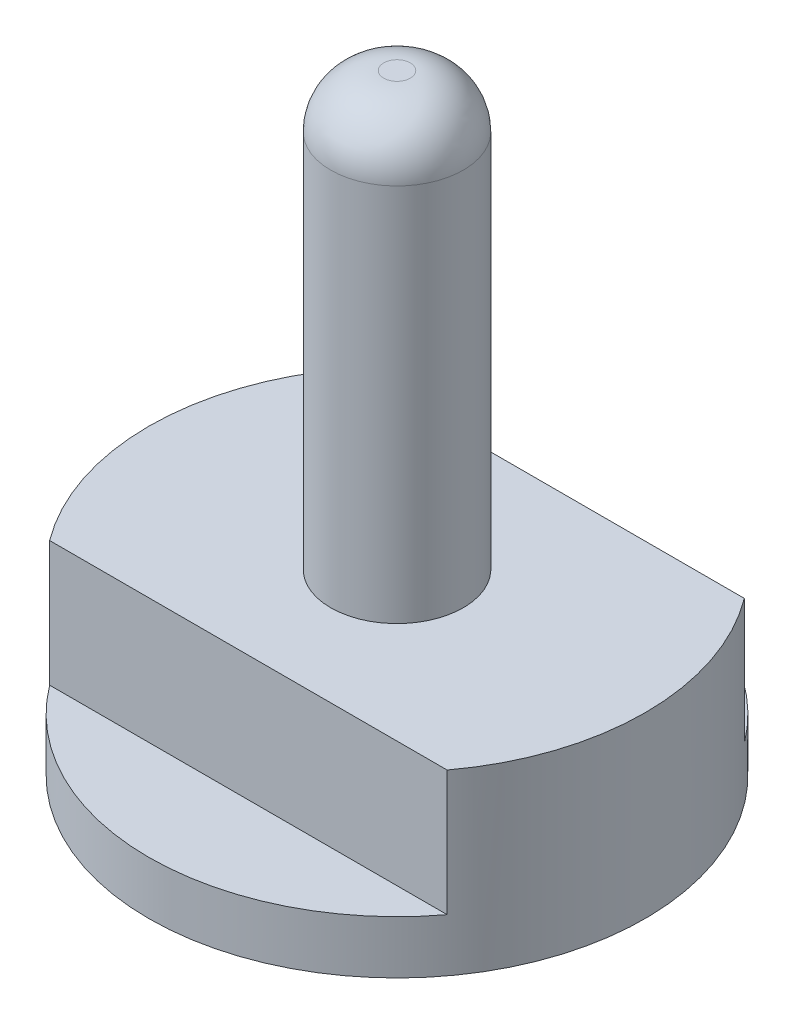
SolidWorks part; units mm, degrees
ref_plane "Plane1" through (0, 0, 0) normal (0, 0, 1) x (1, 0, 0)
ref_plane "Plane2" through (0, 0, 0) normal (0, 1, 0) x (1, 0, 0)
ref_plane "Plane3" through (0, 0, 0) normal (1, 0, 0) x (0, 0, -1)
sketch "Sketch2" plane through (0, 3.36, 0) normal (0, 1, 0) x (-1, 0, 0)
  line L0 (-3.7437, 0) -> (3.7437, 0) construction
  line L1 (-3.7437, 5.6) -> (3.7437, 5.6) construction
  line L2 (-3.7437, 0) -> (3.7437, 0)
  line L3 (-3.7437, 5.6) -> (3.7437, 5.6)
  arc A0 (3.7437, 0) -> (3.7437, 5.6) centre (0, 2.8) ccw construction
  arc A1 (-3.7437, 5.6) -> (-3.7437, 0) centre (0, 2.8) ccw construction
  arc A2 (3.7437, 0) -> (3.7437, 5.6) centre (0, 2.8) ccw
  arc A3 (-3.7437, 5.6) -> (-3.7437, 0) centre (0, 2.8) ccw
extrude "Base-Extrude" add sketch "Sketch2" against normal up to surface (3.36 mm away)
sketch "Sketch3" plane through (0, 3.36, 0) normal (0, 1, 0) x (-1, 0, 0)
  circle A0 centre (0, 2.8) radius 1.25
  arc A1 (3.7437, 0) -> (3.7437, 5.6) centre (0, 2.8) ccw construction
  dimension "D1" = 2.5
extrude "Boss-Extrude1" add sketch "Sketch3" along normal blind 8.14
fillet "Fillet1" radius 1
sketch "Sketch4" plane through (0, 0, 0) normal (0, -1, 0) x (1, 0, 0)
  circle A0 centre (0, 2.8) radius 4.675
  arc A1 (3.7437, 0) -> (3.7437, 5.6) centre (0, 2.8) ccw construction
extrude "Boss-Extrude2" add sketch "Sketch4" against normal blind 1
sketch "Sketch5" plane through (0, 0, 0) normal (0, -1, 0) x (1, 0, 0)
  circle A1 centre (0, 2.8) radius 1.675
  circle A2 centre (0, 2.8) radius 1.675
  circle A3 centre (0, 2.8) radius 1.175
  circle A4 centre (0, 2.8) radius 1.175
  dimension "D1" = 3
  dimension "D2" = 3.5
extrude "Boss-Extrude3" add sketch "Sketch5" along normal blind 2
